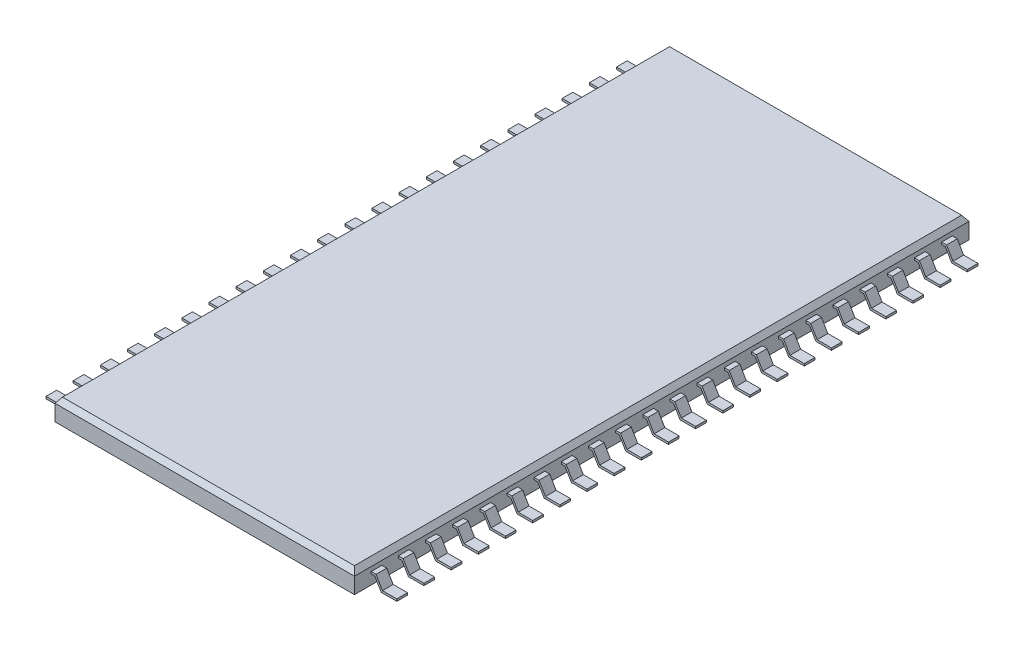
SolidWorks part; units mm, degrees
ref_plane "Front Plane" through (0, 0, 0) normal (0, 0, 1) x (1, 0, 0)
ref_plane "Top Plane" through (0, 0, 0) normal (0, 1, 0) x (1, 0, 0)
ref_plane "Right Plane" through (0, 0, 0) normal (1, 0, 0) x (0, 0, -1)
sketch "Sketch1" plane through (0, 0, 0) normal (0, 1, 0) x (1, 0, 0)
  line L0 (0, 6.8835) -> (0, -6.8835) construction
  line L1 (-5.5575, 0) -> (5.5575, 0) construction
  line L3 (-7, 15) -> (7, 15)
  line L4 (-7, 15) -> (-7, -15)
  line L5 (-7, -15) -> (7, -15)
  line L6 (7, 15) -> (7, -15)
  dimension "D1" = 14
  dimension "D2" = 30
extrude "Extrude1" add sketch "Sketch1" along normal mid plane 1
chamfer "Chamfer1" distance 0.25 angle 35 4 edges at (0, 0.5, -15) (7, 0.5, 0) (0, 0.5, 15) (-7, 0.5, 0)
sketch "Sketch4" plane through (0, 0, 0) normal (0, 0, 1) x (1, 0, 0)
  line L0 (0, 1.2724) -> (0, -0.9364) construction
  line L1 (-7, 1.8525) -> (-7, -1.3157) construction
  line L2 (-7, 0.25) -> (-7, -0.5) construction
  line L3 (0, 0) -> (-6.2695, 0) construction
  line L4 (-8.2, 1.2724) -> (-8.2, -1.1019) construction
  line L5 (-7, 0) -> (-7.2, 0)
  line L6 (-7.2, 0) -> (-7.5, -0.51)
  line L7 (-7.5, -0.51) -> (-8.2, -0.51)
  line L9 (-7, -0.5) -> (7, -0.5) construction
  point P19 (-7.2, 0)
  point P22 (-7.5, -0.51)
  dimension "D1" = 1.2
  dimension "D2" = 0.01
  dimension "D3" = 0.7
  dimension "D4" = 0.2
extrude "Extrude-Thin1" add sketch "Sketch4" along normal mid plane 0.5 thin
pattern_linear "LPattern1" count 12 spacing 1.27 along (0, 0, -1) count 11 spacing 1.27 along (0, 0, 1) of "Extrude-Thin1"
mirror "Mirror1" about plane through (0, 0, 0) normal (1, 0, 0) of "LPattern1", "Extrude-Thin1"
other "Move Face1" parameters "D1"=1.27
